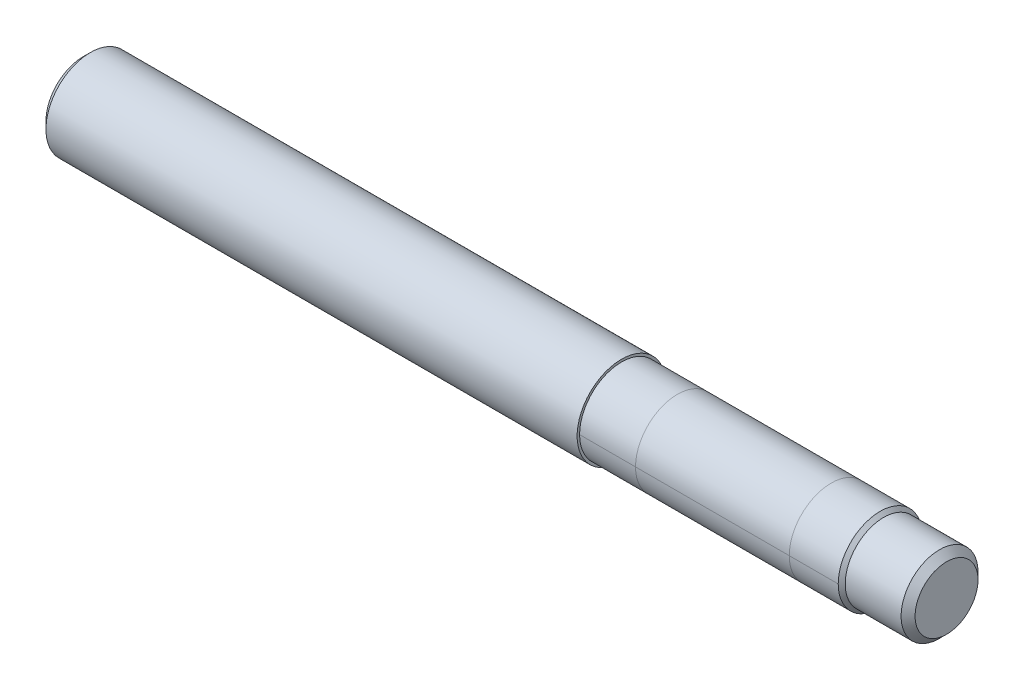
SolidWorks part; units mm, degrees
ref_plane "Front" through (0, 0, 0) normal (0, 0, 1) x (1, 0, 0)
ref_plane "Top" through (0, 0, 0) normal (0, 1, 0) x (1, 0, 0)
ref_plane "Right" through (0, 0, 0) normal (1, 0, 0) x (0, 0, -1)
sketch "Sketch1" plane through (0, 0, 0) normal (1, 0, 0) x (0, 0, -1)
  circle A0 centre (0, 0) radius 6.35
  dimension "D1" = 12.7
extrude "Extrude1" add sketch "Sketch1" along normal blind 123.5
sketch "Sketch2" plane through (123.5, 0, 0) normal (1, 0, 0) x (0, 0, -1)
  circle A0 centre (0, 0) radius 6
  dimension "D1" = 12
extrude "Cut-Extrude1" cut sketch "Sketch2" against normal blind 46.5 flip side to cut
sketch "Sketch3" plane through (0, 0, 0) normal (0, 0, 1) x (1, 0, 0)
  line L0 (123.5, 10.254) -> (123.5, 5.5)
  line L1 (123.5, 5.5) -> (114.5, 5.5)
  line L2 (114.5, 5.5) -> (112.6001, 7.3999)
  line L3 (112.6001, 7.3999) -> (112.6001, 10.254)
  line L4 (112.6001, 10.254) -> (123.5, 10.254)
  line L5 (123.5, -6) -> (123.5, 6) construction
  line L6 (127.965, 0) -> (95.5626, 0) construction
  line L7 (77, 0) -> (0, 0) construction
  dimension "D1" = 11
  dimension "D2" = 9
  dimension "D3" = 45
revolve "Cut-Revolve1" cut sketch "Sketch3" angle 360 about L6
chamfer "Chamfer1" distance 1 angle 45 2 edges at (123.5, 0, -5.5) (0, 0, -6.35)
sketch "Sketch5" plane through (0, 0, 0) normal (0, 0, 1) x (1, 0, 0)
  line L0 (77, 0) -> (114, 0)
  line L1 (77, -6.35) -> (77, 6.35) construction
  line L2 (114, -6) -> (114, 6) construction
sketch "Sketch6" plane through (0, 0, 0) normal (0, 0, 1) x (1, 0, 0)
  line L0 (85.001, 6) -> (85.001, -6)
  line L1 (114, 6) -> (77, 6) construction
  line L2 (77, -6) -> (114, -6) construction
  line L3 (77, -6.35) -> (77, 6.35) construction
  dimension "D1" = 8.001
sketch "Sketch7" plane through (0, 0, 0) normal (0, 0, 1) x (1, 0, 0)
  line L0 (106.9974, 6) -> (106.9974, -6)
  line L3 (77, -6.35) -> (77, 6.35) construction
  dimension "D1" = 29.9974
